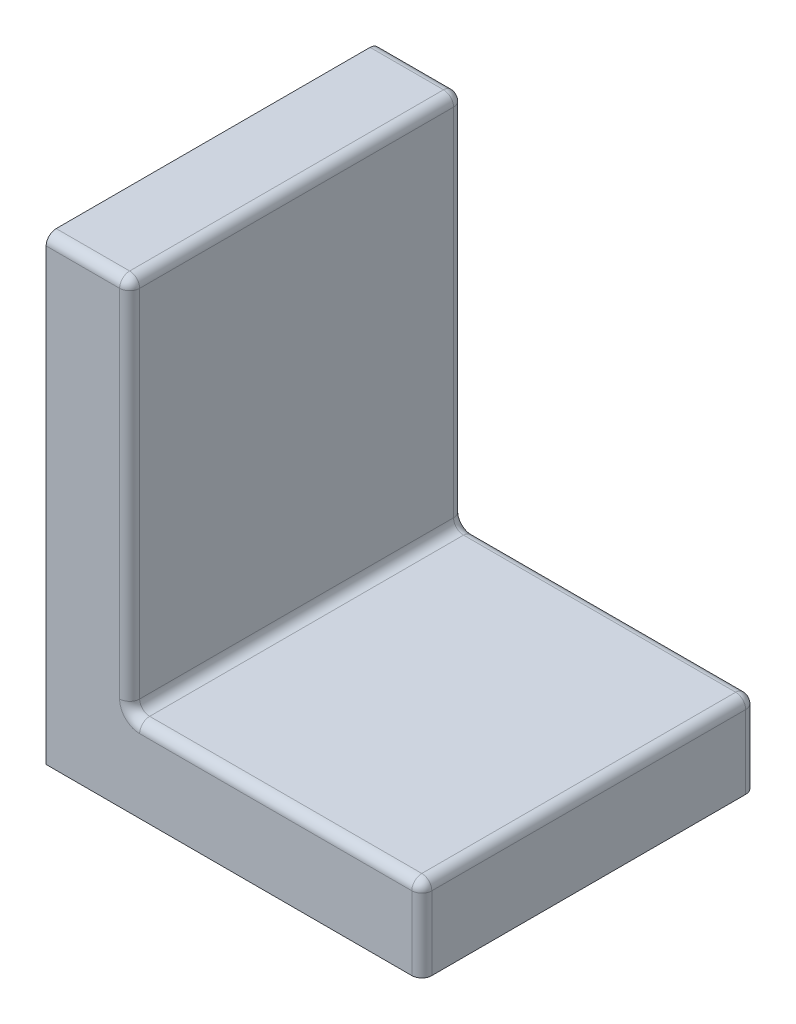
SolidWorks part; units mm, degrees
ref_plane "Front Plane" through (0, 0, 0) normal (0, 0, 1) x (1, 0, 0)
ref_plane "Top Plane" through (0, 0, 0) normal (0, 1, 0) x (1, 0, 0)
ref_plane "Right Plane" through (0, 0, 0) normal (1, 0, 0) x (0, 0, -1)
sketch "Sketch1" plane through (0, 0, 0) normal (0, 0, 1) x (1, 0, 0)
  line L0 (0, 69.85) -> (0, 0)
  line L1 (0, 0) -> (57.15, 0)
  line L2 (57.15, 0) -> (57.15, 12.7)
  line L3 (57.15, 12.7) -> (12.7, 12.7)
  line L4 (12.7, 12.7) -> (12.7, 69.85)
  line L5 (12.7, 69.85) -> (0, 69.85)
  dimension "D1" = 57.15
  dimension "D2" = 69.85
  dimension "D3" = 12.7
  dimension "D4" = 12.7
extrude "Extrude1" add sketch "Sketch1" along normal mid plane 50.8
fillet "Interior Fillet" radius 1.524 1 edges at (12.7, 12.7, 0)
fillet "Fillet2" radius 1.524 4 edges at (57.15, 6.35, -25.4) (57.15, 6.35, 25.4) (6.35, 69.85, -25.4) (6.35, 69.85, 25.4)
fillet "Fillet3" radius 1.524 12 edges at (12.7, 69.4036, 24.9536) (12.7, 41.275, 25.4) (13.1464, 13.1464, 25.4) (34.925, 12.7, 25.4) (56.7036, 12.7, 24.9536) (57.15, 12.7, 0) (56.7036, 12.7, -24.9536) (34.925, 12.7, -25.4) (13.1464, 13.1464, -25.4) (12.7, 41.275, -25.4) (12.7, 69.4036, -24.9536) (12.7, 69.85, 0)
